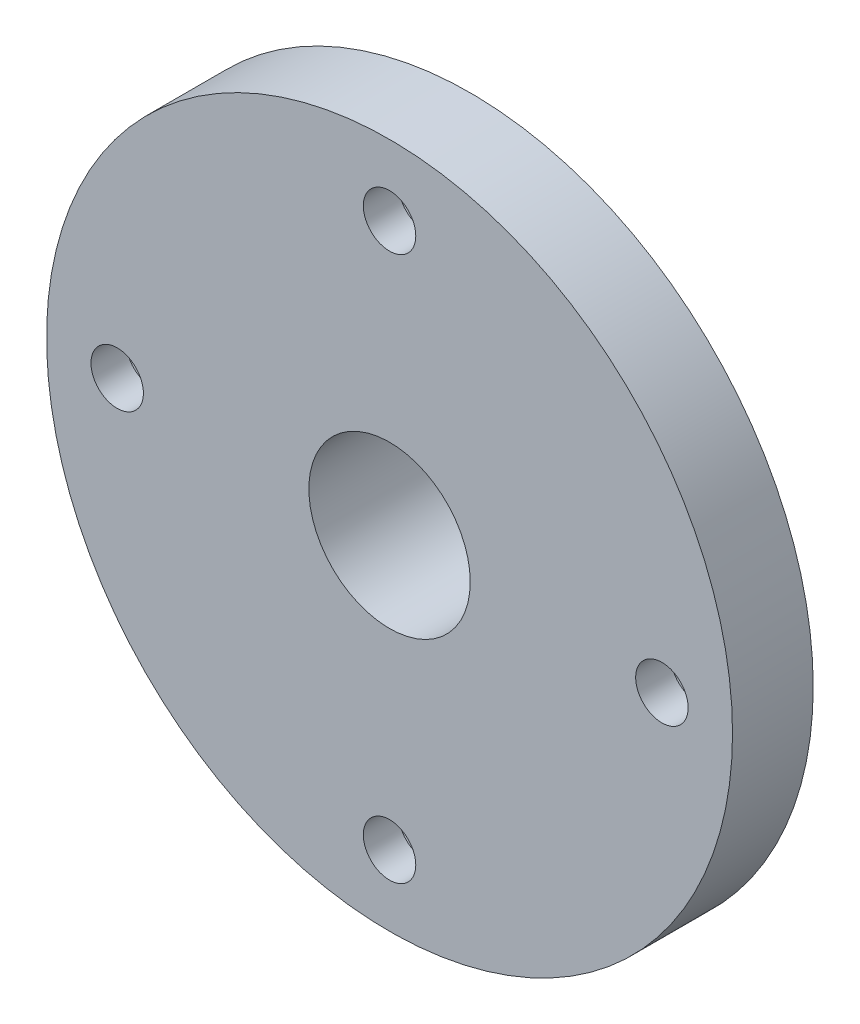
SolidWorks part; units mm, degrees
ref_plane "Plan de face" through (0, 0, 0) normal (0, 0, 1) x (1, 0, 0)
ref_plane "Plan de dessus" through (0, 0, 0) normal (0, 1, 0) x (1, 0, 0)
ref_plane "Plan de droite" through (0, 0, 0) normal (1, 0, 0) x (0, 0, -1)
sketch "Esquisse3" plane through (0, 0, 0) normal (0, 1, 0) x (1, 0, 0)
  line L0 (8, 0) -> (0, 0) construction
  line L1 (8, 18) -> (12.5, 18)
  line L2 (12.5, 18) -> (12.5, 11)
  line L3 (12.5, 11) -> (34, 8)
  line L4 (34, 8) -> (34, 0)
  line L5 (34, 0) -> (8, 0)
  line L6 (0, 0) -> (0, 43.75) construction
  line L7 (8, 18) -> (8, 0)
  line L8 (8, 18) -> (0, 18) construction
  dimension "D1" = 8
  dimension "D2" = 8
  dimension "D3" = 11
  dimension "D4" = 34
  dimension "D5" = 12.5
  dimension "D6" = 18
revolve "Révolution1" add sketch "Esquisse3" angle 360 about L6
fillet "Congé2" radius 5 1 edges at (12.5, 0, -11)
sketch "Esquisse4" plane through (0, 0, -18) normal (0, 0, -1) x (-1, 0, 0)
  circle A0 centre (0, 0) radius 8 construction
  circle A1 centre (0, 0) radius 8
  circle A3 centre (0, 0) radius 11
  dimension "D1" = 22
extrude "Boss.-Extru.3" add sketch "Esquisse4" along normal blind 5
sketch "Esquisse5" plane through (0, 0, 0) normal (0, 0, 1) x (1, 0, 0)
  line L0 (-34, 0) -> (34, 0) construction
  line L1 (0, 34) -> (0, -34) construction
  circle A0 centre (0, 0) radius 34 construction
  circle A1 centre (0, 0) radius 27 construction
  circle A2 centre (-27, 0) radius 2.6
  circle A3 centre (0, 27) radius 2.6
  circle A4 centre (27, 0) radius 2.6
  circle A5 centre (0, -27) radius 2.6
  dimension "D1" = 54
  dimension "D2" = 5.2
  dimension "D3" = 5.2
  dimension "D4" = 5.2
  dimension "D5" = 5.2
extrude "Enlèv. mat.-Extru.1" cut sketch "Esquisse5" against normal through all
ref_plane "Plan1" through (0, 0, -3.5) normal (0, 0, 1) x (1, 0, 0)
sketch "Esquisse6" plane through (0, 0, -3.5) normal (0, 0, 1) x (1, 0, 0)
  circle A0 centre (-27, 0) radius 5
  circle A1 centre (0, 27) radius 5
  circle A2 centre (27, 0) radius 5
  circle A3 centre (0, -27) radius 5
  dimension "D1" = 10
  dimension "D2" = 10
  dimension "D3" = 10
  dimension "D4" = 10
extrude "Enlèv. mat.-Extru.2" cut sketch "Esquisse6" against normal through all
